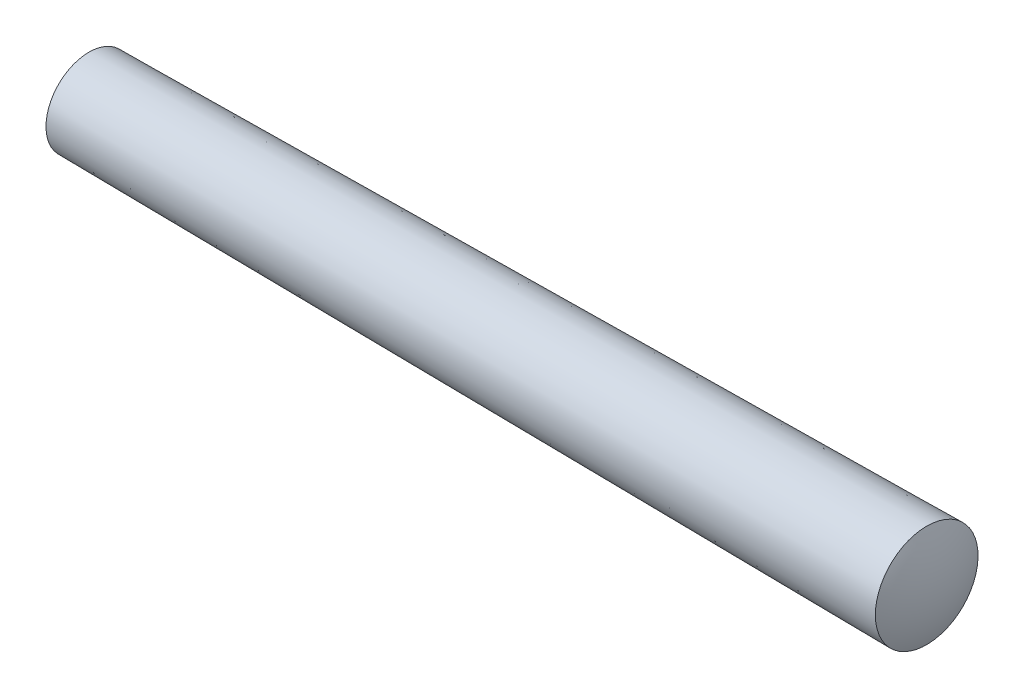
SolidWorks part; units mm, degrees
ref_plane "Plane1" through (0, 0, 0) normal (0, 0, 1) x (1, 0, 0)
ref_plane "Plane2" through (0, 0, 0) normal (0, 1, 0) x (1, 0, 0)
ref_plane "Plane3" through (0, 0, 0) normal (1, 0, 0) x (0, 0, -1)
sketch "Sketch1" plane through (0, 0, 0) normal (0, 0, 1) x (1, 0, 0)
  line L0 (0, 0) -> (210, 0) construction
  line L2 (0.63, 2.5) -> (49.37, 2.9874)
  line L4 (0, 0) -> (50, 0)
  line L5 (0.63, -2.5) -> (49.37, -2.9874) construction
  arc A0 (0.63, 2.5) -> (0, 0) centre (5.2753, 0) ccw
  arc A1 (49.37, 2.9874) -> (50, 0) centre (42.602, 0) cw
  dimension "D1" = 0.63
  dimension "Diameter" = 5
  dimension "D2" = 0.573
  dimension "Length" = 50
  dimension "Crown_ht" = 0.63
revolve "Base-Revolve" add sketch "Sketch1" angle 360 about L0
equation "\"D1@Sketch1\" = \"Crown_ht@Sketch1\""
